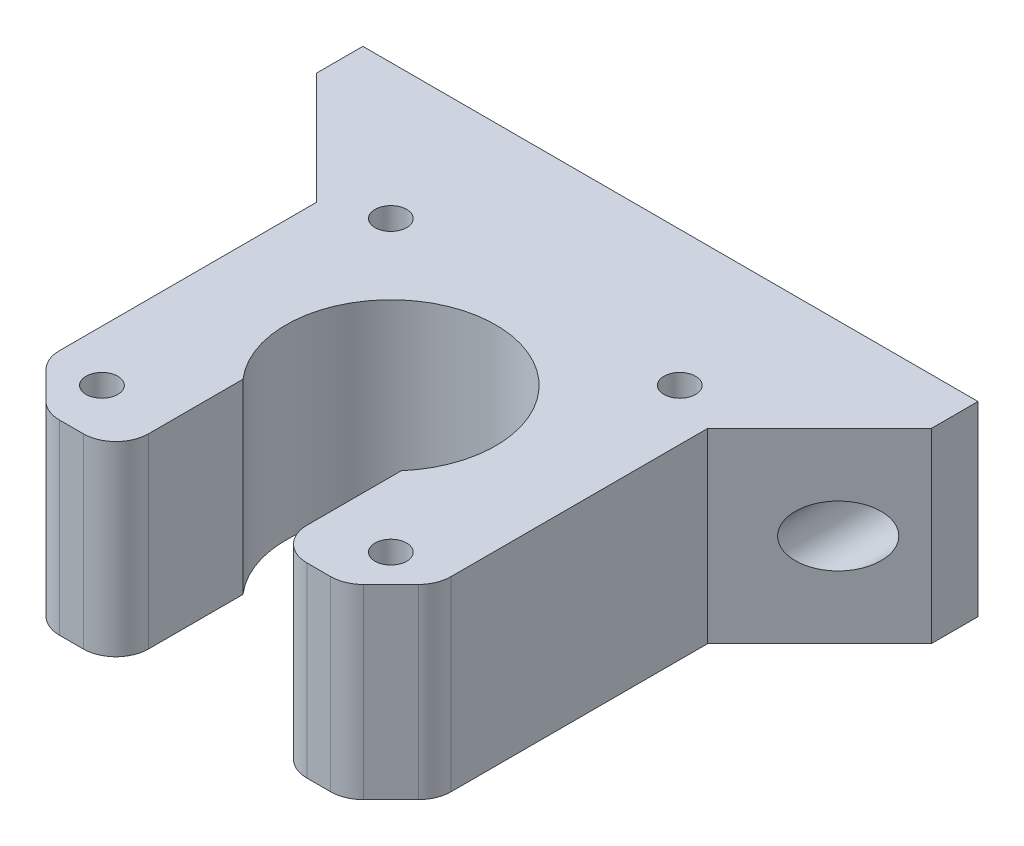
SolidWorks part; units mm, degrees
ref_plane "Aufriss" through (0, 0, 0) normal (0, 0, 1) x (1, 0, 0)
ref_plane "Grundriss" through (0, 0, 0) normal (0, 1, 0) x (1, 0, 0)
ref_plane "Seitenriss" through (0, 0, 0) normal (1, 0, 0) x (0, 0, -1)
sketch "Skizze1" plane through (0, 0, 0) normal (0, 1, 0) x (1, 0, 0)
  line L1 (-21, -21) -> (21, -21)
  line L2 (-21, -21) -> (-21, 21)
  line L3 (-21, 21) -> (21, 21)
  line L4 (21, -21) -> (21, 21)
  line L5 (-21, -21) -> (21, 21) construction
  line L6 (-21, 21) -> (21, -21) construction
  point P0 (0, 0)
  dimension "D1" = 42
  dimension "D2" = 42
extrude "Aufsatz-Linear austragen1" add sketch "Skizze1" along normal mid plane 20
sketch "Skizze2" plane through (0, 10, 0) normal (0, 1, 0) x (1, 0, 0)
  line L2 (-8.5, -21) -> (8.5, -21)
  line L4 (-8.5, -21) -> (-8.5, -7.3697)
  line L5 (8.5, -21) -> (8.5, -7.3697)
  line L6 (-21, -21) -> (21, -21) construction
  arc A0 (8.5, -7.3697) -> (-8.5, -7.3697) centre (0, 0) ccw
  dimension "D1" = 22.5
  dimension "D2" = 8.5
  dimension "D3" = 8.5
extrude "Schnitt-Linear austragen1" cut sketch "Skizze2" against normal through all
hole_wizard "Stirnsenkung für M3 Zylinderschraube mit Innensechskant1" positions "Skizze3" profile "Skizze4" counterbore size "M3" standard "DIN"
sketch "Skizze3" plane through (0, -10, 0) normal (0, -1, 0) x (-1, 0, 0)
  point P0 (15.5, -15.5)
  point P2 (15.5, 15.5)
  point P4 (-15.5, 15.5)
  point P6 (-15.5, -15.5)
  dimension "D1" = 15.5
  dimension "D2" = 15.5
  dimension "D3" = 15.5
  dimension "D4" = 15.5
sketch "Skizze4" plane through (-15.5, -10, 15.5) normal (1, 0, 0) x (0, 0, -1)
  line L0 (0, 0) -> (0, 20)
  line L1 (0, 20) -> (1.7, 20)
  line L3 (1.7, 20) -> (1.7, 3.4)
  line L4 (1.7, 3.4) -> (3.25, 3.4)
  line L5 (3.25, 3.4) -> (3.25, 0)
  line L7 (3.25, 0) -> (0, 0)
  line L11 (0, -6.35) -> (0, 107.95) construction
  dimension "Bohrerdurchmesser" = 3.4
  dimension "Bohrungstiefe" = 20
  dimension "Senkdurchmesser2" = 6.5
  dimension "Senktiefe2" = 3.4
sketch "Skizze5" plane through (0, 0, -21) normal (0, 0, -1) x (-1, 0, 0)
  line L4 (-21, -10) -> (21, -10)
  line L5 (21, -10) -> (21, 10)
  line L6 (21, 10) -> (-21, 10)
  line L7 (-21, 10) -> (-21, -10)
  line L8 (-21, -10) -> (21, -10)
  line L9 (21, -10) -> (21, 10)
  line L10 (21, 10) -> (-21, 10)
  line L11 (-21, 10) -> (-21, -10)
  dimension "D1" = 0
extrude "Aufsatz-Linear austragen2" add sketch "Skizze5" along normal blind 9
sketch "Skizze7" plane through (0, 0, -30) normal (0, 0, -1) x (-1, 0, 0)
  line L0 (21, -10) -> (21, 10) construction
  line L1 (-21, -2.4) -> (21, -2.4)
  line L2 (-21, -2.4) -> (-21, 2.4)
  line L3 (-21, 2.4) -> (21, 2.4)
  line L4 (21, -2.4) -> (21, 2.4)
  line L5 (-21, -2.4) -> (21, 2.4) construction
  line L6 (-21, 2.4) -> (21, -2.4) construction
  point P0 (0, 0)
  dimension "D1" = 4.8
extrude "Aufsatz-Linear austragen3" add sketch "Skizze7" along normal blind 3
chamfer "Fase1" distance 5 angle 45 2 edges at (-21, 0, 21) (21, 0, 21)
fillet "Verrundung1" radius 3.5 6 edges at (21, 0, 16) (16, 0, 21) (-16, 0, 21) (-21, 0, 16) (8.5, 0, 21) (-8.5, 0, 21)
sketch "Skizze8" plane through (0, 10, 0) normal (0, 1, 0) x (1, 0, 0)
  line L0 (-21, 30) -> (-33, 30)
  line L1 (-33, 30) -> (-33, 25)
  line L2 (-33, 25) -> (-21, 13)
  line L3 (-21, 30) -> (-21, -14.5503) construction
  line L4 (-21, 13) -> (-21, 30)
  line L5 (21, 30) -> (33, 30)
  line L6 (33, 30) -> (33, 25)
  line L7 (33, 25) -> (21, 13)
  line L8 (21, -14.5503) -> (21, 30) construction
  line L9 (21, 13) -> (21, 30)
  dimension "D1" = 5
  dimension "D2" = 12
  dimension "D3" = 45
extrude "Aufsatz-Linear austragen4" add sketch "Skizze8" against normal up to surface (20 mm away)
ref_plane "Ebene1" through (0, 0, -25) normal (0, 0, -1) x (-1, 0, 0)
hole_wizard "Stirnsenkung für M3 Zylinderschraube mit Innensechskant2" positions "Skizze11" profile "Skizze12" counterbore size "M3" standard "DIN"
sketch "Skizze11" plane through (0, 0, -25) normal (0, 0, -1) x (-1, 0, 0)
  line L0 (33, -10) -> (33, 10) construction
  line L1 (-33, -10) -> (-33, 10) construction
  point P0 (28, 0)
  point P2 (-28, 0)
  dimension "D1" = 5
  dimension "D2" = 5
sketch "Skizze12" plane through (-28, 0, -25) normal (1, 0, 0) x (0, -1, 0)
  line L0 (0, 0) -> (0, 8)
  line L1 (0, 8) -> (1.7, 8)
  line L3 (1.7, 8) -> (1.7, 3.4)
  line L4 (1.7, 3.4) -> (3.25, 3.4)
  line L5 (3.25, 3.4) -> (3.25, 0)
  line L7 (3.25, 0) -> (0, 0)
  line L11 (0, -6.35) -> (0, 107.95) construction
  dimension "Bohrerdurchmesser" = 3.4
  dimension "Bohrungstiefe" = 8
  dimension "Senkdurchmesser2" = 6.5
  dimension "Senktiefe2" = 3.4
sketch "Skizze13" plane through (0, 0, -25) normal (0, 0, -1) x (-1, 0, 0)
  circle A0 centre (-28, 0) radius 3.25 construction
  circle A1 centre (28, 0) radius 3.25 construction
  circle A2 centre (-28, 0) radius 3.25
  circle A3 centre (28, 0) radius 3.25
extrude "Schnitt-Linear austragen2" cut sketch "Skizze13" against normal through all
sketch "Skizze14" plane through (0, 0, -33) normal (0, 0, -1) x (-1, 0, 0)
  line L0 (-21, -2.4) -> (21, -2.4) construction
  line L1 (-21, 2.4) -> (-18, 2.4)
  line L2 (-21, 2.4) -> (-21, -2.4)
  line L3 (-21, -2.4) -> (-18, -2.4)
  line L4 (-18, 2.4) -> (-18, -2.4)
  line L5 (-21, -2.4) -> (21, -2.4) construction
  line L6 (21, 2.4) -> (18, 2.4)
  line L7 (21, 2.4) -> (21, -2.4)
  line L8 (21, -2.4) -> (18, -2.4)
  line L9 (18, 2.4) -> (18, -2.4)
  dimension "D1" = 3
extrude "Schnitt-Linear austragen3" cut sketch "Skizze14" against normal up to surface (3 mm away)
